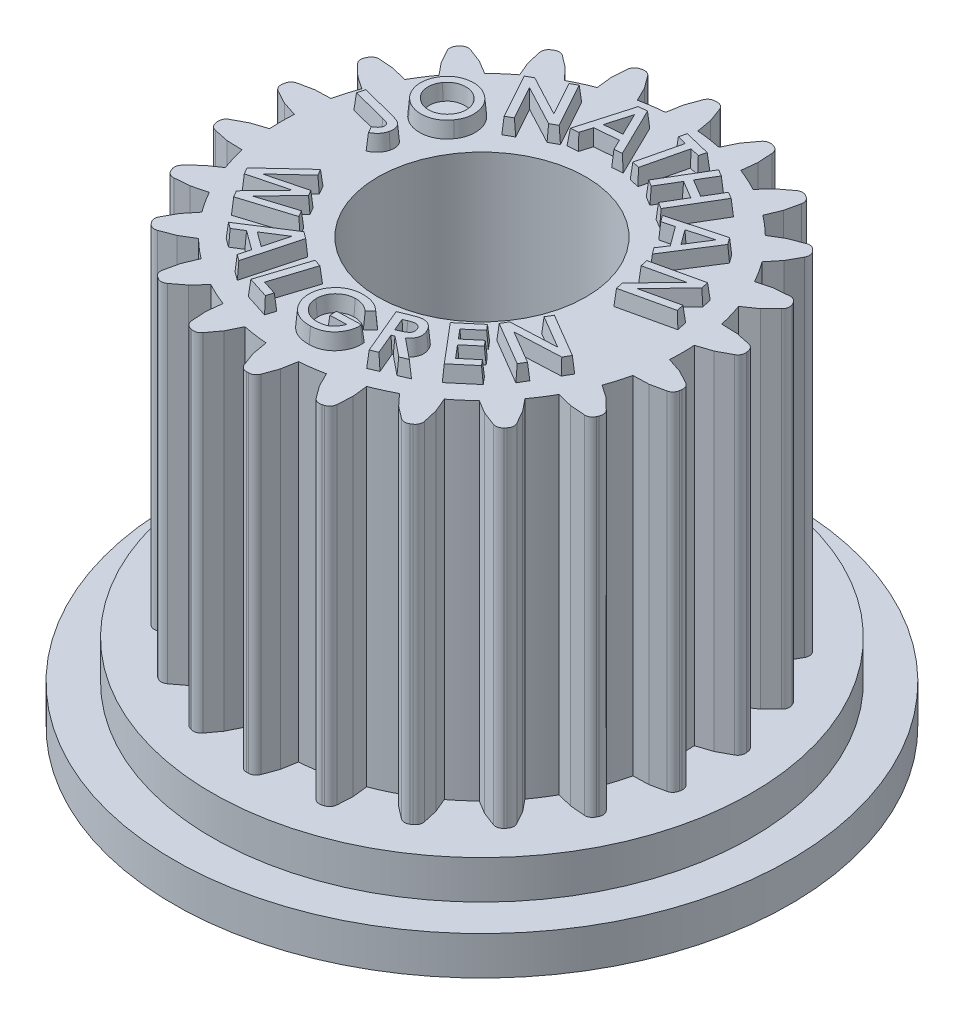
SolidWorks part; units mm, degrees
ref_plane "Front Plane" through (0, 0, 0) normal (0, 0, 1) x (1, 0, 0)
ref_plane "Top Plane" through (0, 0, 0) normal (0, 1, 0) x (1, 0, 0)
ref_plane "Right Plane" through (0, 0, 0) normal (1, 0, 0) x (0, 0, -1)
sketch "Sketch1" plane through (0, 0, 0) normal (0, 1, 0) x (1, 0, 0)
  circle A0 centre (0, 0) radius 33.02
  circle A1 centre (0, 0) radius 17.145
  dimension "D1" = 66.04
  dimension "D2" = 34.29
extrude "Boss-Extrude1" add sketch "Sketch1" along normal blind 63.5
sketch "Sketch2" plane through (0, 63.5, 0) normal (0, 1, 0) x (1, 0, 0)
  line L0 (-2.667, 32.9121) -> (2.667, 32.9121)
  line L1 (2.667, 32.9121) -> (2.2191, 35.4521)
  line L2 (2.2191, 35.4521) -> (1.3677, 37.7915)
  line L3 (0.1743, 38.6271) -> (-0.1743, 38.6271)
  line L4 (-1.3677, 37.7915) -> (-2.2191, 35.4521)
  line L5 (-2.2191, 35.4521) -> (-2.667, 32.9121)
  circle A0 centre (0, 0) radius 33.02 construction
  arc A1 (1.3677, 37.7915) -> (0.1743, 38.6271) centre (0.1743, 37.3571) ccw
  arc A2 (-1.3677, 37.7915) -> (-0.1743, 38.6271) centre (-0.1743, 37.3571) cw
  point P11 (1.0635, 38.6271)
  dimension "D8" = 1.27
  dimension "D1" = 5.334
  dimension "D2" = 80
  dimension "D3" = 80
  dimension "D4" = 2.54
  dimension "D5" = 110
  dimension "D6" = 110
  dimension "D7" = 3.175
extrude "Boss-Extrude2" add sketch "Sketch2" against normal blind 63.5
pattern_circular "CirPattern1" count 22 over 360 about axis through (0, 0, 0) along (0, 1, 0) of "Boss-Extrude2"
sketch "Sketch3" plane through (0, 0, 0) normal (0, -1, 0) x (-1, 0, 0)
  circle A0 centre (0, 0) radius 44.45
  dimension "D1" = 88.9
extrude "Boss-Extrude3" add sketch "Sketch3" against normal blind 6.35
sketch "Sketch5" plane through (0, 0, 0) normal (0, -1, 0) x (-1, 0, 0)
  circle A0 centre (0, 0) radius 50.8
  dimension "D1" = 101.6
extrude "Boss-Extrude5" add sketch "Sketch5" along normal blind 6.35
sketch "Sketch6" plane through (0, 63.5, 0) normal (0, 1, 0) x (1, 0, 0)
  circle A0 centre (0, 0) radius 20.955 construction
  circle A1 centre (0, 0) radius 17.145 construction
  circle A2 centre (0, 0) radius 29.845 construction
  circle A3 centre (0, 0) radius 17.145 construction
  text T0 "<b>   JONATHAN</b>" font "Century Gothic" height 8.89
  text T1 "<b>       WALGREN  </b>" font "Century Gothic" height 8.89
  dimension "D1" = 3.81
  dimension "D2" = 8.89
sketch "Sketch8" plane through (0, -6.35, 0) normal (0, -1, 0) x (-1, 0, 0)
  line L1 (-19.05, 19.05) -> (19.05, 19.05)
  line L2 (-19.05, 19.05) -> (-19.05, -19.05)
  line L3 (-19.05, -19.05) -> (19.05, -19.05)
  line L4 (19.05, 19.05) -> (19.05, -19.05)
  dimension "D1" = 19.05
  dimension "D2" = 19.05
  dimension "D3" = 38.1
  dimension "D4" = 38.1
extrude "Cut-Extrude2" cut sketch "Sketch8" against normal blind 12.7
sketch "Sketch9" plane through (0, 6.35, 0) normal (0, -1, 0) x (-1, 0, 0)
  circle A0 centre (0, 0) radius 22.225
extrude "Boss-Extrude6" add sketch "Sketch9" against normal blind 12.7
extrude "Boss-Extrude7" add sketch "Sketch6" along normal blind 2.54 draft 5
